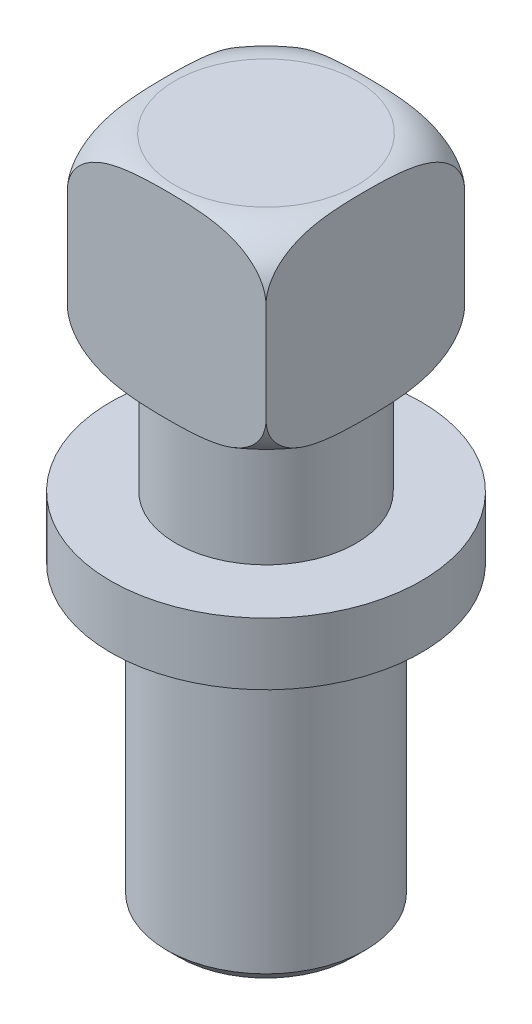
SolidWorks part; units mm, degrees
ref_plane "Front" through (0, 0, 0) normal (0, 0, 1) x (1, 0, 0)
ref_plane "Top" through (0, 0, 0) normal (0, 1, 0) x (1, 0, 0)
ref_plane "Right" through (0, 0, 0) normal (1, 0, 0) x (0, 0, -1)
sketch "Sketch1" plane through (0, 0, 0) normal (0, 1, 0) x (1, 0, 0)
  line L0 (8, -8) -> (-8, 8) construction
  line L1 (-8, 8) -> (8, 8)
  line L2 (-8, 8) -> (-8, -8)
  line L3 (-8, -8) -> (8, -8)
  line L4 (8, 8) -> (8, -8)
  dimension "D1" = 16
extrude "Extrude1" add sketch "Sketch1" along normal blind 16
ref_plane "Plane1" through (0, 0, 0) normal (-0.7071, 0, -0.7071) x (-0.7071, 0, 0.7071)
sketch "Sketch2" plane through (0, 0, 0) normal (-0.7071, 0, -0.7071) x (-0.7071, 0, 0.7071)
  line L2 (0, 16) -> (11.3137, 16) construction
  line L3 (11.3137, 16) -> (11.3137, 0) construction
  line L4 (7.3137, 16) -> (7.3137, 17.606)
  line L5 (7.3137, 17.606) -> (12.4503, 17.606)
  line L6 (12.4503, 17.606) -> (12.4503, 12)
  line L7 (12.4503, 12) -> (11.3137, 12)
  line L8 (0, 0) -> (0, 18.7218) construction
  line L9 (-11.3137, 8) -> (11.3137, 8) construction
  line L10 (-11.3137, 16) -> (-11.3137, 0) construction
  line L11 (12.4503, 4) -> (11.3137, 4)
  line L12 (12.4503, -1.606) -> (12.4503, 4)
  line L13 (7.3137, -1.606) -> (12.4503, -1.606)
  line L14 (7.3137, 0) -> (7.3137, -1.606)
  arc A0 (11.3137, 12) -> (7.3137, 16) centre (7.3137, 12) ccw
  arc A1 (11.3137, 4) -> (7.3137, 0) centre (7.3137, 4) cw
  dimension "D1" = 4
revolve "Cut-Revolve1" cut sketch "Sketch2" angle 360 about L8
sketch "Sketch3" plane through (0, 0, 0) normal (0, 0, 1) x (1, 0, 0)
  line L0 (0, 0) -> (0, -37.5774) construction
  line L1 (0, 0) -> (7.25, 0)
  line L2 (-7.3137, 0) -> (7.3137, 0) construction
  line L3 (7.25, 0) -> (7.25, -9)
  line L4 (7.25, -9) -> (12.5, -9)
  line L5 (12.5, -9) -> (12.5, -14)
  line L6 (12.5, -14) -> (8, -14)
  line L7 (8, -14) -> (8, -38)
  line L8 (8, -38) -> (0, -38)
  line L9 (0, -38) -> (0, 0)
  line L10 (7.3137, 16) -> (-7.3137, 16) construction
  dimension "D1" = 14.5
  dimension "D2" = 25
  dimension "D3" = 16
  dimension "D4" = 24
  dimension "D5" = 5
  dimension "D6" = 25
revolve "Revolve1" add sketch "Sketch3" angle 360 about L0
chamfer "Chamfer1" distance 1 angle 45
